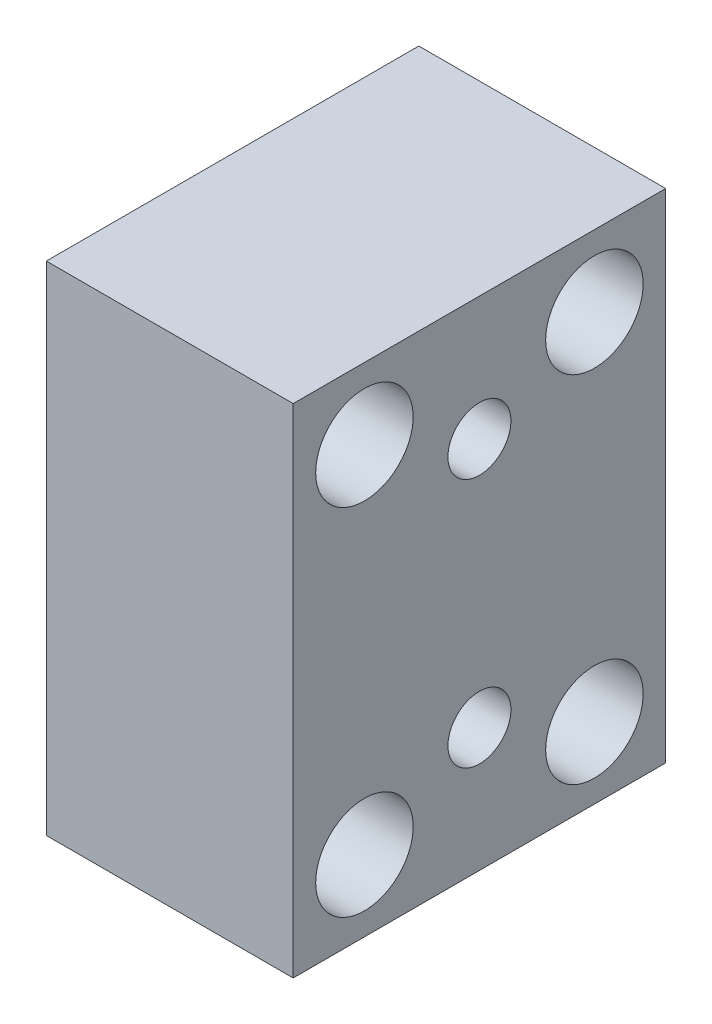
SolidWorks part; units mm, degrees
ref_plane "Front Plane" through (0, 0, 0) normal (0, 0, 1) x (1, 0, 0)
ref_plane "Top Plane" through (0, 0, 0) normal (0, 1, 0) x (1, 0, 0)
ref_plane "Right Plane" through (0, 0, 0) normal (1, 0, 0) x (0, 0, -1)
ref_plane "Plane1" through (-12.573, 0, 0) normal (1, 0, 0) x (0, 0, -1)
ref_plane "Plane2" through (0, -25.273, 0) normal (0, 1, 0) x (-1, 0, 0)
ref_plane "Plane3" through (0, 0, -18.923) normal (0, 0, 1) x (1, 0, 0)
sketch "Sketch1" plane through (0, 0, -18.923) normal (0, 0, 1) x (1, 0, 0)
  line L0 (-12.5412, -25.273) -> (12.5412, -25.273)
  line L1 (12.5412, -25.273) -> (12.5412, 25.273)
  line L2 (12.5412, 25.273) -> (-12.5413, 25.273)
  line L3 (-12.5413, 25.273) -> (-12.5412, -25.273)
  line L4 (-12.5413, 25.273) -> (12.5412, -25.273) construction
  dimension "D1" = 25.0825
  dimension "D2" = 50.546
extrude "Extrude1" add sketch "Sketch1" along normal blind 37.846
ref_plane "Plane4" through (0, 0, 0) normal (0, 0, 1) x (1, 0, 0)
ref_plane "Plane5" through (-12.573, 0, 0) normal (1, 0, 0) x (0, 0, -1)
ref_plane "Plane6" through (0, 0, 11.176) normal (0, 0, 1) x (1, 0, 0)
ref_plane "Plane7" through (0, 0, -10.922) normal (0, 0, 1) x (1, 0, 0)
ref_plane "Plane8" through (0, 0, 0) normal (0, 0, 1) x (1, 0, 0)
ref_plane "Plane9" through (0, 0, -11.684) normal (0, 0, 1) x (1, 0, 0)
sketch "Sketch7" plane through (0, 0, -11.684) normal (0, 0, 1) x (1, 0, 0)
  line L0 (-12.573, 18.034) -> (-12.573, 22.987)
  line L1 (-12.573, 22.987) -> (12.573, 22.987)
  line L2 (12.573, 22.987) -> (12.573, 18.034)
  line L3 (12.573, 18.034) -> (-12.573, 18.034)
  line L4 (12.573, 18.034) -> (-12.573, 18.034) construction
sketch "Sketch8" plane through (0, 0, -11.684) normal (0, 0, 1) x (1, 0, 0)
  line L0 (4.191, -18.034) -> (4.191, -13.081)
  line L1 (4.191, -13.081) -> (20.955, -13.081)
  line L2 (20.955, -13.081) -> (20.955, -18.034)
  line L3 (20.955, -18.034) -> (4.191, -18.034)
  line L4 (20.955, -18.034) -> (4.191, -18.034) construction
revolve "Cut-Revolve5" cut sketch "Sketch7" angle 360 about L4
ref_plane "Plane10" through (0, 0, 11.684) normal (0, 0, 1) x (1, 0, 0)
sketch "Sketch9" plane through (0, 0, 11.684) normal (0, 0, 1) x (1, 0, 0)
  line L0 (-12.573, -18.034) -> (-12.573, -13.081)
  line L1 (-12.573, -13.081) -> (12.573, -13.081)
  line L2 (12.573, -13.081) -> (12.573, -18.034)
  line L3 (12.573, -18.034) -> (-12.573, -18.034)
  line L4 (12.573, -18.034) -> (-12.573, -18.034) construction
revolve "Cut-Revolve6" cut sketch "Sketch9" angle 360 about L4
sketch "Sketch10" plane through (-12.573, 0, 0) normal (1, 0, 0) x (0, 0, -1)
  circle A0 centre (-11.684, 18.034) radius 4.5593
extrude "Cut-Extrude1" cut sketch "Sketch10" along normal blind 12.573
sketch "Sketch11" plane through (-12.573, 0, 0) normal (1, 0, 0) x (0, 0, -1)
  circle A0 centre (11.684, -18.034) radius 4.5593
extrude "Cut-Extrude2" cut sketch "Sketch11" along normal blind 12.573
sketch "Sketch12" plane through (0, 0, -11.684) normal (0, 0, 1) x (1, 0, 0)
  line L0 (-12.573, -18.034) -> (-12.573, -15.2984)
  line L1 (-11.6611, -14.3866) -> (0, -14.3866)
  line L2 (0, -14.3866) -> (0, -18.034)
  line L3 (0, -18.034) -> (-12.573, -18.034)
  line L4 (0, -18.034) -> (-12.573, -18.034) construction
  arc A0 (-12.573, -15.2984) -> (-11.6611, -14.3866) centre (-11.6611, -15.2984) cw
revolve "Revolve1" add sketch "Sketch12" angle 360 about L4
sketch "Sketch13" plane through (-12.573, 0, 0) normal (1, 0, 0) x (0, 0, -1)
  line L0 (10.414, -17.3008) -> (10.414, -18.7672)
  line L1 (10.414, -18.7672) -> (11.684, -19.5005)
  line L2 (11.684, -19.5005) -> (12.954, -18.7672)
  line L3 (12.954, -18.7672) -> (12.954, -17.3008)
  line L4 (12.954, -17.3008) -> (11.684, -16.5675)
  line L5 (11.684, -16.5675) -> (10.414, -17.3008)
extrude "Cut-Extrude3" cut sketch "Sketch13" along normal blind 6.2865
ref_plane "Plane11" through (0, 0, 11.684) normal (0, 0, 1) x (1, 0, 0)
sketch "Sketch14" plane through (0, 0, 11.684) normal (0, 0, 1) x (1, 0, 0)
  line L0 (-12.573, 18.034) -> (-12.573, 20.7696)
  line L1 (-11.6611, 21.6814) -> (0, 21.6814)
  line L2 (0, 21.6814) -> (0, 18.034)
  line L3 (0, 18.034) -> (-12.573, 18.034)
  line L4 (0, 18.034) -> (-12.573, 18.034) construction
  arc A0 (-12.573, 20.7696) -> (-11.6611, 21.6814) centre (-11.6611, 20.7696) cw
revolve "Revolve2" add sketch "Sketch14" angle 360 about L4
sketch "Sketch15" plane through (-12.573, 0, 0) normal (1, 0, 0) x (0, 0, -1)
  line L0 (-12.954, 18.7672) -> (-12.954, 17.3008)
  line L1 (-12.954, 17.3008) -> (-11.684, 16.5675)
  line L2 (-11.684, 16.5675) -> (-10.414, 17.3008)
  line L3 (-10.414, 17.3008) -> (-10.414, 18.7672)
  line L4 (-10.414, 18.7672) -> (-11.684, 19.5005)
  line L5 (-11.684, 19.5005) -> (-12.954, 18.7672)
extrude "Cut-Extrude4" cut sketch "Sketch15" along normal blind 6.2865
sketch "Sketch16" plane through (0, 0, 0) normal (0, 0, 1) x (1, 0, 0)
  line L0 (4.191, -12.7) -> (4.191, -9.4996)
  line L1 (4.191, -9.4996) -> (20.955, -9.4996)
  line L2 (20.955, -9.4996) -> (20.955, -12.7)
  line L3 (20.955, -12.7) -> (4.191, -12.7)
  line L4 (20.955, -12.7) -> (4.191, -12.7) construction
ref_plane "Plane12" through (0, 0, 11.303) normal (0, 0, 1) x (1, 0, 0)
ref_plane "Plane13" through (0, 0, 0) normal (0, 0, 1) x (1, 0, 0)
ref_plane "Plane14" through (0, 0, 19.177) normal (0, 0, 1) x (1, 0, 0)
revolve "Cut-Revolve9" cut sketch "Sketch8" angle 360 about L4
ref_plane "Plane15" through (4.191, 0, 0) normal (1, 0, 0) x (0, 0, -1)
ref_plane "Plane16" through (0, 0, 11.684) normal (0, 0, 1) x (1, 0, 0)
sketch "Sketch18" plane through (0, 0, 11.684) normal (0, 0, 1) x (1, 0, 0)
  line L0 (4.191, 18.034) -> (4.191, 22.987)
  line L1 (4.191, 22.987) -> (20.955, 22.987)
  line L2 (20.955, 22.987) -> (20.955, 18.034)
  line L3 (20.955, 18.034) -> (4.191, 18.034)
  line L4 (20.955, 18.034) -> (4.191, 18.034) construction
revolve "Cut-Revolve10" cut sketch "Sketch18" angle 360 about L4
revolve "Cut-Revolve11" cut sketch "Sketch16" angle 360 about L4
ref_plane "Plane17" through (0, 0, 0) normal (0, 0, 1) x (1, 0, 0)
sketch "Sketch19" plane through (0, 0, 0) normal (0, 0, 1) x (1, 0, 0)
  line L0 (4.191, 12.7) -> (4.191, 15.9004)
  line L1 (4.191, 15.9004) -> (20.955, 15.9004)
  line L2 (20.955, 15.9004) -> (20.955, 12.7)
  line L3 (20.955, 12.7) -> (4.191, 12.7)
  line L4 (20.955, 12.7) -> (4.191, 12.7) construction
revolve "Cut-Revolve12" cut sketch "Sketch19" angle 360 about L4
hole_wizard "#10-32 Tapped Hole1" positions "Sketch21" profile "Sketch20" tap size "#10-32" standard "Ansi Inch"
sketch "Sketch21" plane through (-12.5413, 0, 0) normal (-1, 0, 0) x (0, 0, 1)
  line L0 (-11.1125, 0) -> (11.1125, 0) construction
  line L2 (0, 20.6375) -> (0, -20.6375) construction
  point P0 (0, 20.6375)
  point P1 (-11.1125, 0)
  point P3 (11.1125, 0)
  point P5 (0, -20.6375)
  dimension "D1" = 41.275
  dimension "D2" = 22.225
sketch "Sketch20" plane through (-12.5413, 20.6375, 0) normal (0, 1, 0) x (0, 0, 1)
  line L0 (0, 0) -> (0, 16.2534)
  line L1 (0, 16.2534) -> (2.0193, 15.0876)
  line L2 (2.0193, 15.0876) -> (2.0193, 0)
  line L5 (2.0193, 0) -> (0, 0)
  line L10 (0, 16.2534) -> (-2.0193, 15.0876) construction
  line L11 (0, -6.35) -> (0, 107.95) construction
  dimension "Tap Drill Dia." = 4.0386
  dimension "Tap Drill Depth" = 15.0876
  dimension "Drill Angle" = 120
hole_wizard "3/16 (0.1875) Diameter Hole1" positions "Sketch23" profile "Sketch22" hole size "3/16" standard "Ansi Inch"
sketch "Sketch23" plane through (-12.5413, 0, 0) normal (-1, 0, 0) x (0, 0, 1)
  line L0 (0, 12.7) -> (0, -12.7) construction
  point P0 (0, 12.7)
  point P1 (0, -12.7)
  dimension "D1" = 25.4
sketch "Sketch22" plane through (-12.5413, 12.7, 0) normal (0, 1, 0) x (0, 0, 1)
  line L0 (0, 0) -> (0, 14.1308)
  line L1 (0, 14.1308) -> (2.3812, 12.7)
  line L2 (2.3812, 12.7) -> (2.3812, 0)
  line L5 (2.3812, 0) -> (0, 0)
  line L10 (0, 14.1308) -> (-2.3813, 12.7) construction
  line L11 (0, -6.35) -> (0, 107.95) construction
  dimension "Hole Dia." = 4.7625
  dimension "Hole Depth" = 12.7
  dimension "Drill Angle" = 118
